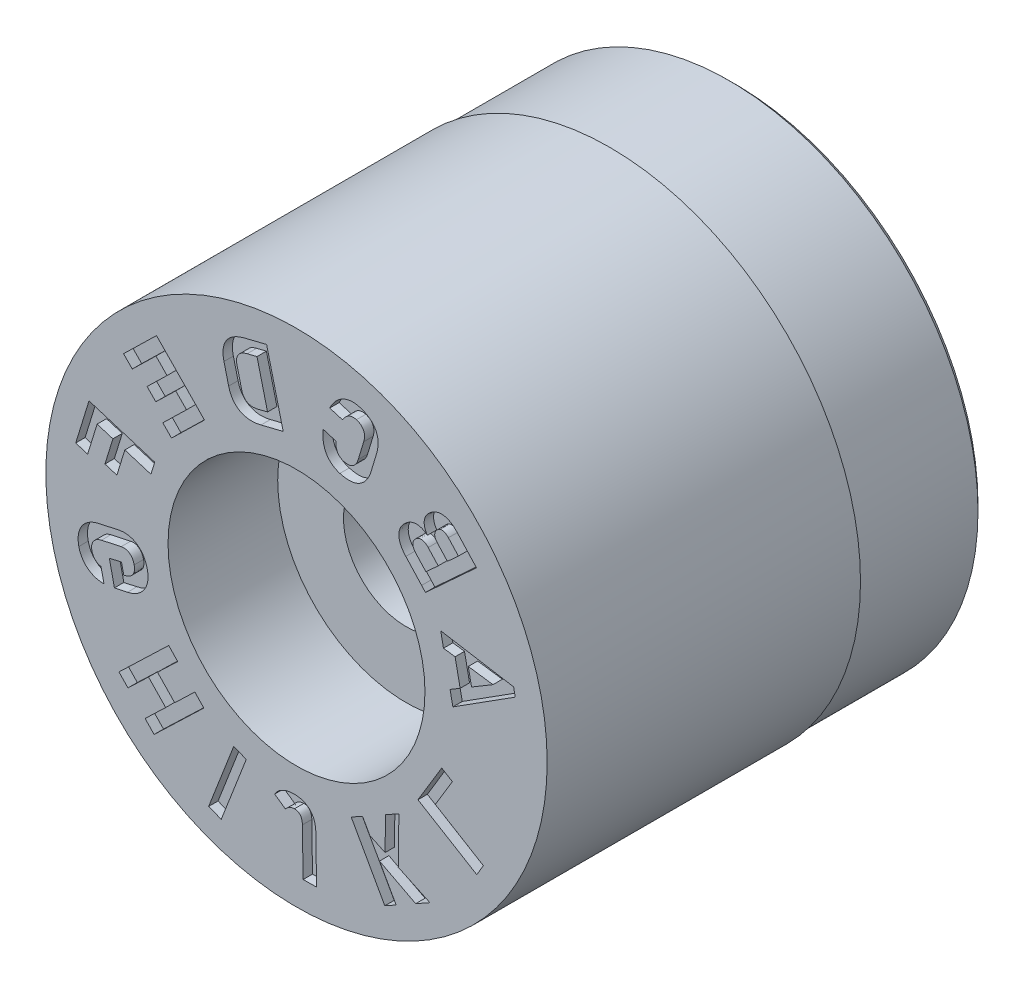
SolidWorks part; units mm, degrees
ref_plane "Front Plane" through (0, 0, 0) normal (0, 0, 1) x (1, 0, 0)
ref_plane "Top Plane" through (0, 0, 0) normal (0, 1, 0) x (1, 0, 0)
ref_plane "Right Plane" through (0, 0, 0) normal (1, 0, 0) x (0, 0, -1)
sketch "Sketch1" plane through (0, 0, 0) normal (1, 0, 0) x (0, 0, -1)
  line L2 (0, 8) -> (0, 4.1)
  line L3 (13.75, 8) -> (0, 8)
  line L4 (-3.7979, 0) -> (49996.2021, 0) construction
  line L8 (14, 2) -> (3.5, 2)
  line L9 (3.5, 4.1) -> (3.5, 2)
  line L10 (3.5, 4.1) -> (0, 4.1)
  line L12 (14, 2) -> (14, 7.75)
  line L16 (14, 7.75) -> (13.75, 8)
  dimension "D1" = 14
  dimension "D2" = 45
  dimension "D3" = 0.25
  dimension "D4" = 16
  dimension "D5" = 8.2
  dimension "D6" = 3.5
  dimension "D7" = 4
revolve "Revolve1" add sketch "Sketch1" angle 360 about L4
sketch "Sketch4" plane through (0, 0, 0) normal (1, 0, 0) x (0, 0, -1)
  line L0 (0, 0) -> (50000, 0) construction
  line L1 (14, -7.75) -> (14, 7.75) construction
  line L2 (10, 8.935) -> (14, 8.935)
  line L3 (10, 8.935) -> (10, 7.935)
  line L4 (10, 7.935) -> (14, 7.935)
  line L5 (14, 8.935) -> (14, 7.935)
  line L6 (13.75, 8) -> (0, 8) construction
  line L9 (0, 8.8) -> (0, -8.8) construction
  dimension "D1" = 1
  dimension "D2" = 0.065
  dimension "D3" = 10
revolve "Cut-Revolve1" cut sketch "Sketch4" angle 360 about L0
sketch "Sketch6" plane through (0, 0, 0) normal (0, 0, 1) x (1, 0, 0)
  line L0 (6.9817, 1.2949) -> (6.929, 1.5531)
  line L1 (6.929, 1.5531) -> (4.6018, 1.9394)
  line L2 (4.6018, 1.9394) -> (4.6909, 1.5014)
  line L3 (4.6909, 1.5014) -> (5.0619, 1.4505)
  line L4 (6.2709, 1.2848) -> (5.5869, 0.8767)
  line L5 (4.9014, 0.4676) -> (4.9905, 0.0295)
  line L6 (4.9905, 0.0295) -> (6.9817, 1.2949)
  line L7 (5.5869, 0.8767) -> (5.4817, 1.393)
  line L8 (4.522, 3.6936) -> (4.1302, 3.3334)
  line L9 (5.0619, 1.4505) -> (5.2231, 0.6595)
  line L10 (5.2231, 0.6595) -> (4.9014, 0.4676)
  line L11 (4.1302, 3.3334) -> (3.8113, 3.6802)
  line L12 (3.8023, 4.0792) -> (3.8053, 4.0821)
  line L13 (4.2031, 4.0404) -> (4.522, 3.6936)
  line L14 (4.0893, -2.7406) -> (3.8759, -3.0942)
  line L15 (4.8172, 3.9651) -> (4.4982, 4.3121)
  line L16 (4.8474, 4.6331) -> (5.1664, 4.2862)
  line L18 (5.744, 4.2516) -> (5.1335, 4.9155)
  line L19 (3.4759, 4.3493) -> (3.472, 4.346)
  line L20 (3.4891, 3.4379) -> (3.9933, 2.8893)
  line L21 (3.9933, 2.8893) -> (4.1168, 2.7554)
  line L23 (5.1664, 4.2862) -> (4.8172, 3.9651)
  line L25 (4.1168, 2.7554) -> (5.744, 4.2516)
  line L26 (2.3808, 5.2332) -> (2.5547, 5.8097)
  line L27 (1.0611, 6.3256) -> (1.4711, 6.2019)
  line L28 (2.1443, 5.9337) -> (1.9703, 5.3572)
  line L29 (1.2615, 5.509) -> (0.8515, 5.6328)
  line L30 (-0.9245, 5.2236) -> (-1.238, 5.1461)
  line L31 (-1.7451, 5.4095) -> (-1.9006, 6.0396)
  line L32 (-1.5746, 6.5087) -> (-1.2613, 6.5862)
  line L33 (-0.8286, 4.8355) -> (-0.8285, 4.8352)
  line L34 (-0.9542, 7.0741) -> (-1.6616, 6.8991)
  line L35 (-2.3151, 5.9241) -> (-2.1654, 5.3184)
  line L36 (-1.1318, 4.7606) -> (-0.4255, 4.935)
  line L37 (-3.8544, 4.3421) -> (-3.5111, 3.9901)
  line L38 (-5.4786, 1.8971) -> (-4.6459, 1.6405)
  line L39 (-1.2613, 6.5862) -> (-0.9245, 5.2236)
  line L40 (-4.4349, -3.7249) -> (-3.7914, -3.1071)
  line L41 (-0.4255, 4.935) -> (-0.9542, 7.0741)
  line L42 (-4.1757, -4.5714) -> (-4.8322, -5.2017)
  line L43 (-4.4856, 4.9892) -> (-4.132, 4.6267)
  line L44 (2.3399, -4.8503) -> (2.1077, -4.4351)
  line L45 (-2.9378, 3.9936) -> (-4.4682, 5.5626)
  line L46 (-3.5111, 3.9901) -> (-4.2666, 3.2533)
  line L47 (-4.2666, 3.2533) -> (-3.9889, 2.9684)
  line L48 (-3.9889, 2.9684) -> (-2.9378, 3.9936)
  line L49 (2.828, -5.0785) -> (2.3399, -4.8503)
  line L50 (-4.132, 4.6267) -> (-4.7686, 4.0057)
  line L51 (-4.7686, 4.0057) -> (-4.4909, 3.7212)
  line L52 (-4.4909, 3.7212) -> (-3.8544, 4.3421)
  line L53 (4.0893, -2.7406) -> (4.0891, -2.7406)
  line L54 (-4.4682, 5.5626) -> (-5.5192, 4.5374)
  line L55 (-5.5192, 4.5374) -> (-5.2411, 4.2524)
  line L56 (-5.2411, 4.2524) -> (-4.4856, 4.9892)
  line L57 (5.4817, 1.393) -> (6.2709, 1.2848)
  line L59 (-6.363, 2.1696) -> (-5.8596, 2.0145)
  line L60 (-4.6459, 1.6405) -> (-4.5243, 2.036)
  line L61 (-4.5243, 2.036) -> (-6.6222, 2.6825)
  line L62 (-5.8596, 2.0145) -> (-6.1135, 1.1906)
  line L63 (-6.1135, 1.1906) -> (-5.7323, 1.0733)
  line L64 (-5.7323, 1.0733) -> (-5.4786, 1.8971)
  line L66 (-6.6222, 2.6825) -> (-7.0468, 1.3044)
  line L67 (-7.0468, 1.3044) -> (-6.6656, 1.1872)
  line L68 (-6.6656, 1.1872) -> (-6.363, 2.1696)
  line L70 (-5.8115, -2.0829) -> (-5.3934, -1.9925)
  line L71 (-5.6862, -0.4165) -> (-6.317, -0.5537)
  line L72 (-6.1449, -2.1365) -> (-6.2396, -1.7012)
  line L73 (-6.2264, -0.9712) -> (-5.5956, -0.834)
  line L74 (-5.4785, -1.573) -> (-5.5135, -1.5806)
  line L75 (-5.5135, -1.5806) -> (-5.5839, -1.2569)
  line L76 (-5.5839, -1.2569) -> (-5.9727, -1.3413)
  line L77 (-5.9727, -1.3413) -> (-5.8115, -2.0829)
  line L78 (-4.8322, -5.2017) -> (-4.5449, -5.5008)
  line L79 (-4.5449, -5.5008) -> (-2.9569, -3.9763)
  line L80 (-2.9569, -3.9763) -> (-3.2443, -3.6772)
  line L81 (-3.2443, -3.6772) -> (-3.8877, -4.2949)
  line L82 (-5.6667, -4.3325) -> (-5.3794, -4.6316)
  line L83 (-5.3794, -4.6316) -> (-4.7229, -4.0014)
  line L84 (-3.7914, -3.1071) -> (-4.0788, -2.808)
  line L85 (-4.0788, -2.808) -> (-5.6667, -4.3325)
  line L86 (-4.7229, -4.0014) -> (-4.1757, -4.5714)
  line L88 (-3.8877, -4.2949) -> (-4.4349, -3.7249)
  line L90 (-1.603, -4.7178) -> (-2.0048, -4.562)
  line L91 (-2.0048, -4.562) -> (-2.8038, -6.6189)
  line L92 (-2.8038, -6.6189) -> (-2.402, -6.7747)
  line L93 (-2.402, -6.7747) -> (-1.603, -4.7178)
  line L94 (-0.6972, -5.2231) -> (-0.3544, -5.465)
  line L95 (0.1882, -5.633) -> (0.2101, -7.1323)
  line L96 (0.2101, -7.1323) -> (0.6396, -7.1259)
  line L97 (0.6396, -7.1259) -> (0.6176, -5.6249)
  line L98 (2.6487, -5.4024) -> (3.804, -6.0022)
  line L99 (3.804, -6.0022) -> (4.259, -5.7478)
  line L100 (4.259, -5.7478) -> (3.2472, -5.2746)
  line L102 (2.8182, -6.5535) -> (3.1795, -6.3516)
  line L103 (3.1795, -6.3516) -> (2.6487, -5.4024)
  line L104 (2.1077, -4.4351) -> (1.7464, -4.6371)
  line L105 (1.7464, -4.6371) -> (2.8182, -6.5535)
  line L107 (3.2472, -5.2746) -> (3.2674, -3.7862)
  line L108 (3.2674, -3.7862) -> (2.8388, -4.0259)
  line L109 (2.8388, -4.0259) -> (2.828, -5.0785)
  line L110 (5.7523, -4.2251) -> (5.9649, -3.8724)
  line L111 (5.9649, -3.8724) -> (4.43, -2.9462)
  line L113 (3.8759, -3.0942) -> (5.7523, -4.2251)
  line L114 (4.43, -2.9462) -> (4.9748, -2.0432)
  line L115 (4.9748, -2.0432) -> (4.634, -1.8378)
  line L116 (4.634, -1.8378) -> (4.0893, -2.7406)
  spline S0 degree 3 poles (3.8113, 3.6802) (3.7827, 3.7118) (3.7454, 3.7619) (3.7179, 3.8365) (3.7103, 3.8896) (3.7151, 3.9417) (3.7392, 4.0101) (3.7743, 4.0541) (3.8023, 4.0792) knots 0 0 0 0 0.28358 0.40678 0.523554 0.636467 0.749848 1 1 1 1
  spline S1 degree 3 poles (3.8053, 4.0821) (3.8245, 4.0997) (3.855, 4.1232) (3.9002, 4.1443) (3.9339, 4.1541) (3.9679, 4.1593) (4.0023, 4.1577) (4.0369, 4.1519) (4.0711, 4.1394) (4.1055, 4.1226) (4.1518, 4.0915) (4.1833, 4.0622) (4.2031, 4.0404) knots 0 0 0 0 0.172169 0.251661 0.327831 0.402694 0.477732 0.553965 0.63336 0.717035 0.805718 1 1 1 1
  spline S2 degree 3 poles (4.4982, 4.3121) (4.4725, 4.3407) (4.4381, 4.3861) (4.415, 4.4546) (4.4091, 4.5034) (4.4152, 4.5513) (4.4389, 4.6151) (4.4724, 4.6561) (4.4987, 4.6801) knots 0 0 0 0 0.278439 0.400073 0.51501 0.62887 0.743441 1 1 1 1
  spline S3 degree 3 poles (4.4987, 4.6801) (4.5222, 4.702) (4.5626, 4.7287) (4.6236, 4.7428) (4.6694, 4.7419) (4.7155, 4.7304) (4.7797, 4.6993) (4.8212, 4.6612) (4.8474, 4.6331) knots 0 0 0 0 0.243029 0.353983 0.466706 0.583917 0.708816 1 1 1 1
  spline S4 degree 3 poles (5.1335, 4.9155) (5.0884, 4.9642) (5.0178, 5.0312) (4.9125, 5.0994) (4.8355, 5.1382) (4.7578, 5.1645) (4.68, 5.1785) (4.6024, 5.181) (4.5253, 5.17) (4.4493, 5.1475) (4.3475, 5.0996) (4.2779, 5.0479) (4.2347, 5.0078) knots 0 0 0 0 0.194494 0.282692 0.366303 0.445926 0.521873 0.596751 0.672045 0.748593 0.8277 1 1 1 1
  spline S5 degree 3 poles (4.2347, 5.0078) (4.2047, 4.9802) (4.1646, 4.9351) (4.1227, 4.8681) (4.0998, 4.8162) (4.0839, 4.7628) (4.0749, 4.708) (4.0742, 4.6521) (4.0794, 4.595) (4.0929, 4.5373) (4.1207, 4.4581) (4.1513, 4.4012) (4.1756, 4.3649) knots 0 0 0 0 0.172073 0.253315 0.332707 0.410642 0.487805 0.566183 0.646352 0.729137 0.815534 1 1 1 1
  spline S6 degree 3 poles (4.1756, 4.3649) (4.1402, 4.3951) (4.0832, 4.4332) (4.0022, 4.471) (3.9417, 4.4895) (3.8812, 4.5011) (3.8206, 4.5032) (3.7601, 4.4982) (3.7003, 4.4841) (3.6415, 4.4624) (3.563, 4.422) (3.5098, 4.3801) (3.4759, 4.3493) knots 0 0 0 0 0.179926 0.264185 0.345402 0.424519 0.502196 0.579789 0.658904 0.739474 0.822221 1 1 1 1
  spline S7 degree 3 poles (3.472, 4.346) (3.4278, 4.3065) (3.3711, 4.2405) (3.3137, 4.1429) (3.2852, 4.0682) (3.2687, 3.9917) (3.2636, 3.9136) (3.2718, 3.8344) (3.2913, 3.7543) (3.323, 3.674) (3.3837, 3.5637) (3.4439, 3.487) (3.4891, 3.4379) knots 0 0 0 0 0.172248 0.25144 0.328386 0.403802 0.478629 0.555147 0.634504 0.717947 0.805522 1 1 1 1
  spline S8 degree 3 poles (1.3845, 4.6804) (1.4231, 4.6688) (1.4809, 4.6541) (1.5579, 4.6412) (1.6135, 4.6358) (1.6675, 4.6333) (1.7205, 4.6342) (1.7718, 4.6396) (1.8221, 4.6474) (1.8708, 4.6591) (1.9179, 4.6743) (1.9631, 4.693) (2.0067, 4.7151) (2.0483, 4.7406) (2.0886, 4.7691) (2.1272, 4.801) (2.1639, 4.8365) (2.1982, 4.8755) (2.231, 4.9171) (2.2614, 4.962) (2.2897, 5.0101) (2.3157, 5.0614) (2.3481, 5.1353) (2.3688, 5.1933) (2.3808, 5.2332) knots 0 0 0 0 0.093409 0.137863 0.180596 0.222679 0.263196 0.303035 0.342218 0.380913 0.418858 0.456774 0.494122 0.531903 0.569698 0.60835 0.647655 0.687839 0.728452 0.770331 0.813316 0.857575 0.903607 1 1 1 1
  spline S9 degree 3 poles (2.5547, 5.8097) (2.5669, 5.8496) (2.5824, 5.909) (2.5957, 5.9885) (2.602, 6.0456) (2.6053, 6.1014) (2.6049, 6.1557) (2.6007, 6.2086) (2.5936, 6.2601) (2.5826, 6.3097) (2.5686, 6.3578) (2.551, 6.4039) (2.5301, 6.4483) (2.506, 6.4908) (2.4788, 6.5315) (2.4483, 6.5705) (2.414, 6.6071) (2.377, 6.6422) (2.3367, 6.6749) (2.2935, 6.7054) (2.2471, 6.7335) (2.1978, 6.7595) (2.1264, 6.7914) (2.0703, 6.8114) (2.0316, 6.8228) knots 0 0 0 0 0.096527 0.142046 0.186449 0.229401 0.271233 0.31213 0.352061 0.391448 0.429759 0.46796 0.505512 0.543104 0.580942 0.618791 0.657554 0.69685 0.736812 0.777643 0.819189 0.862318 0.906505 1 1 1 1
  spline S10 degree 3 poles (2.0316, 6.8228) (1.9687, 6.8417) (1.8726, 6.8607) (1.7444, 6.8593) (1.6522, 6.8465) (1.5627, 6.8221) (1.4769, 6.7847) (1.3952, 6.7358) (1.3176, 6.6752) (1.2448, 6.6038) (1.152, 6.4911) (1.0952, 6.394) (1.0611, 6.3256) knots 0 0 0 0 0.164532 0.242888 0.320012 0.397205 0.474318 0.553482 0.635125 0.720033 0.808421 1 1 1 1
  spline S11 degree 3 poles (1.4711, 6.2019) (1.4882, 6.2324) (1.5161, 6.2755) (1.5607, 6.3254) (1.5949, 6.3576) (1.6309, 6.3849) (1.6683, 6.4072) (1.7072, 6.4236) (1.7469, 6.4356) (1.7876, 6.4422) (1.8433, 6.4429) (1.885, 6.436) (1.912, 6.4272) knots 0 0 0 0 0.194907 0.284821 0.372021 0.455712 0.536106 0.61366 0.690482 0.766447 0.842395 1 1 1 1
  spline S12 degree 3 poles (1.912, 6.4272) (1.9465, 6.4167) (1.9959, 6.3969) (2.053, 6.3585) (2.0881, 6.3255) (2.1181, 6.2892) (2.1406, 6.2481) (2.1578, 6.2036) (2.1682, 6.1552) (2.1722, 6.1037) (2.1683, 6.0287) (2.1556, 5.9719) (2.1443, 5.9337) knots 0 0 0 0 0.174749 0.255028 0.331954 0.40698 0.481695 0.557948 0.637228 0.720133 0.807077 1 1 1 1
  spline S13 degree 3 poles (1.9703, 5.3572) (1.9586, 5.3193) (1.938, 5.2648) (1.899, 5.2007) (1.8672, 5.1601) (1.8321, 5.1256) (1.793, 5.0987) (1.7517, 5.0767) (1.7067, 5.063) (1.6594, 5.0554) (1.5906, 5.0549) (1.5387, 5.0662) (1.504, 5.076) knots 0 0 0 0 0.192671 0.280441 0.36332 0.441932 0.518111 0.592729 0.667999 0.744932 0.824738 1 1 1 1
  spline S14 degree 3 poles (1.504, 5.076) (1.4766, 5.0849) (1.4365, 5.1007) (1.3899, 5.1328) (1.359, 5.1604) (1.3319, 5.1921) (1.3088, 5.2274) (1.2906, 5.2667) (1.2755, 5.309) (1.2653, 5.3548) (1.2569, 5.4217) (1.2582, 5.4737) (1.2615, 5.509) knots 0 0 0 0 0.159963 0.23603 0.31203 0.38846 0.465863 0.54484 0.627517 0.714071 0.803748 1 1 1 1
  spline S15 degree 3 poles (0.8515, 5.6328) (0.8428, 5.5566) (0.8371, 5.444) (0.8521, 5.2984) (0.873, 5.1985) (0.9042, 5.1054) (0.9447, 5.0193) (0.9961, 4.9413) (1.0561, 4.8707) (1.1254, 4.8086) (1.2318, 4.7373) (1.3217, 4.6994) (1.3845, 4.6804) knots 0 0 0 0 0.192196 0.280692 0.365902 0.447264 0.526138 0.603429 0.680429 0.757536 0.835747 1 1 1 1
  spline S16 degree 3 poles (-1.238, 5.1461) (-1.2694, 5.1383) (-1.3158, 5.1297) (-1.3771, 5.1249) (-1.4196, 5.1261) (-1.4602, 5.1298) (-1.4985, 5.1385) (-1.5352, 5.1492) (-1.5692, 5.1652) (-1.6011, 5.1838) (-1.6303, 5.2062) (-1.6565, 5.2322) (-1.6806, 5.2609) (-1.701, 5.2934) (-1.725, 5.3422) (-1.7388, 5.3817) (-1.7451, 5.4095) knots 0 0 0 0 0.149228 0.217861 0.283381 0.345618 0.405909 0.464496 0.522086 0.578808 0.635036 0.69159 0.748735 0.807622 0.868398 1 1 1 1
  spline S17 degree 3 poles (-1.9006, 6.0396) (-1.9074, 6.0671) (-1.9149, 6.1083) (-1.9157, 6.1627) (-1.9127, 6.201) (-1.9052, 6.2376) (-1.8943, 6.2727) (-1.8784, 6.3058) (-1.8591, 6.3374) (-1.8357, 6.3668) (-1.8094, 6.3948) (-1.7783, 6.4191) (-1.7448, 6.4423) (-1.7071, 6.4621) (-1.6515, 6.4879) (-1.6056, 6.5002) (-1.5746, 6.5087) knots 0 0 0 0 0.131132 0.192274 0.251269 0.308207 0.364357 0.420562 0.477522 0.53501 0.593964 0.654495 0.71702 0.781929 0.851101 1 1 1 1
  spline S18 degree 3 poles (-1.6616, 6.8991) (-1.7047, 6.8883) (-1.7676, 6.8704) (-1.848, 6.8406) (-1.9038, 6.8161) (-1.9568, 6.79) (-2.0064, 6.7614) (-2.0528, 6.7303) (-2.0962, 6.6973) (-2.1367, 6.6626) (-2.1731, 6.6253) (-2.2066, 6.5866) (-2.2362, 6.5457) (-2.2621, 6.5029) (-2.2849, 6.4585) (-2.3043, 6.4121) (-2.3198, 6.3638) (-2.332, 6.3139) (-2.3405, 6.2624) (-2.3457, 6.2095) (-2.3469, 6.1551) (-2.3444, 6.0993) (-2.3366, 6.0217) (-2.3248, 5.9632) (-2.3151, 5.9241) knots 0 0 0 0 0.09973 0.146796 0.192589 0.236591 0.279607 0.321141 0.361993 0.401988 0.440751 0.479038 0.516883 0.554086 0.591445 0.628895 0.66689 0.70543 0.74425 0.784019 0.824757 0.866366 0.909455 1 1 1 1
  spline S19 degree 3 poles (-2.1654, 5.3184) (-2.1558, 5.2811) (-2.1399, 5.2262) (-2.1121, 5.1566) (-2.089, 5.1076) (-2.0631, 5.0616) (-2.0351, 5.0177) (-2.0043, 4.9768) (-1.9714, 4.9381) (-1.936, 4.9025) (-1.8979, 4.8701) (-1.8576, 4.8406) (-1.8148, 4.8144) (-1.7695, 4.7914) (-1.722, 4.7714) (-1.6721, 4.7542) (-1.62, 4.7404) (-1.5656, 4.7299) (-1.5092, 4.723) (-1.4509, 4.7205) (-1.3907, 4.7211) (-1.3287, 4.7255) (-1.2416, 4.7361) (-1.1759, 4.7493) (-1.1318, 4.7606) knots 0 0 0 0 0.08669 0.128285 0.168675 0.208371 0.247191 0.285672 0.323608 0.361264 0.398546 0.435996 0.473542 0.511424 0.550135 0.589389 0.630087 0.671473 0.714012 0.75773 0.802701 0.849378 0.897596 1 1 1 1
  spline S20 degree 3 poles (-5.3934, -1.9925) (-5.3549, -1.9839) (-5.2981, -1.969) (-5.2256, -1.9427) (-5.1744, -1.9202) (-5.1255, -1.8957) (-5.0793, -1.8679) (-5.0352, -1.8382) (-4.9939, -1.8053) (-4.9552, -1.7706) (-4.9197, -1.7335) (-4.8871, -1.6946) (-4.858, -1.6536) (-4.8316, -1.6109) (-4.8091, -1.5659) (-4.7887, -1.5192) (-4.7721, -1.4706) (-4.7584, -1.4207) (-4.7487, -1.3695) (-4.742, -1.3172) (-4.7386, -1.2638) (-4.7394, -1.2093) (-4.7451, -1.1344) (-4.7534, -1.078) (-4.7621, -1.0404) knots 0 0 0 0 0.092156 0.136526 0.17972 0.222247 0.26394 0.305281 0.346167 0.386703 0.426415 0.465827 0.504837 0.543477 0.582641 0.622094 0.662004 0.702317 0.742521 0.783501 0.824948 0.867208 0.910296 1 1 1 1
  spline S21 degree 3 poles (-4.7621, -1.0404) (-4.77, -1.0024) (-4.7853, -0.9469) (-4.8111, -0.8758) (-4.8325, -0.8253) (-4.8569, -0.7775) (-4.8837, -0.7318) (-4.9127, -0.6883) (-4.9447, -0.6477) (-4.9787, -0.6097) (-5.0145, -0.5745) (-5.0523, -0.5425) (-5.0918, -0.5134) (-5.1334, -0.4874) (-5.1768, -0.4645) (-5.222, -0.4444) (-5.2691, -0.428) (-5.3176, -0.4148) (-5.3672, -0.4041) (-5.4179, -0.398) (-5.4696, -0.3948) (-5.5224, -0.3944) (-5.595, -0.4004) (-5.6498, -0.4078) (-5.6862, -0.4165) knots 0 0 0 0 0.092648 0.137413 0.180621 0.223496 0.265481 0.307091 0.348218 0.388978 0.428755 0.468199 0.507033 0.545944 0.585143 0.624335 0.663972 0.704011 0.744352 0.785068 0.825952 0.867964 0.910999 1 1 1 1
  spline S22 degree 3 poles (-6.317, -0.5537) (-6.3555, -0.5623) (-6.4123, -0.5771) (-6.4848, -0.6035) (-6.5359, -0.6259) (-6.5845, -0.6506) (-6.631, -0.6776) (-6.675, -0.7075) (-6.7162, -0.7401) (-6.7546, -0.775) (-6.7901, -0.8118) (-6.8223, -0.8508) (-6.8514, -0.8918) (-6.878, -0.9344) (-6.901, -0.979) (-6.9208, -1.0257) (-6.9374, -1.0742) (-6.9513, -1.1242) (-6.9605, -1.1757) (-6.9676, -1.2279) (-6.9701, -1.2814) (-6.9701, -1.3358) (-6.9641, -1.4108) (-6.9561, -1.4673) (-6.9473, -1.5048) knots 0 0 0 0 0.092244 0.136656 0.179891 0.22211 0.263807 0.305187 0.346111 0.386354 0.426103 0.465239 0.504286 0.543253 0.582238 0.621471 0.661418 0.70177 0.742297 0.783316 0.824639 0.867081 0.91021 1 1 1 1
  spline S23 degree 3 poles (-6.9473, -1.5048) (-6.934, -1.5666) (-6.9049, -1.6567) (-6.8459, -1.7666) (-6.7938, -1.8421) (-6.7335, -1.9104) (-6.666, -1.9705) (-6.5917, -2.0222) (-6.5111, -2.0647) (-6.4252, -2.098) (-6.3038, -2.1302) (-6.2086, -2.1372) (-6.1449, -2.1365) knots 0 0 0 0 0.17073 0.253607 0.335993 0.417805 0.498918 0.579599 0.661589 0.744332 0.827763 1 1 1 1
  spline S24 degree 3 poles (-6.2396, -1.7012) (-6.2634, -1.6996) (-6.298, -1.6906) (-6.3418, -1.6724) (-6.3725, -1.6542) (-6.4015, -1.633) (-6.4281, -1.6084) (-6.4519, -1.5807) (-6.4952, -1.5207) (-6.519, -1.4623) (-6.5294, -1.4141) knots 0 0 0 0 0.163404 0.244249 0.326188 0.408642 0.491198 0.574875 0.659834 1 1 1 1
  spline S25 degree 3 poles (-6.5294, -1.4141) (-6.5362, -1.3802) (-6.5428, -1.3291) (-6.5356, -1.2622) (-6.5249, -1.2151) (-6.5067, -1.1707) (-6.483, -1.1296) (-6.4532, -1.092) (-6.4174, -1.0586) (-6.3766, -1.0291) (-6.3142, -0.9952) (-6.2621, -0.9795) (-6.2264, -0.9712) knots 0 0 0 0 0.172071 0.252891 0.332752 0.411492 0.489737 0.568063 0.648792 0.732039 0.817587 1 1 1 1
  spline S26 degree 3 poles (-5.5956, -0.834) (-5.564, -0.8266) (-5.5161, -0.8228) (-5.4533, -0.829) (-5.4091, -0.8405) (-5.3673, -0.8582) (-5.3283, -0.8812) (-5.2936, -0.9112) (-5.2619, -0.9456) (-5.2345, -0.9855) (-5.2027, -1.0461) (-5.1881, -1.0967) (-5.18, -1.1312) knots 0 0 0 0 0.168953 0.2486 0.327822 0.406131 0.484587 0.563012 0.644083 0.727995 0.814612 1 1 1 1
  spline S27 degree 3 poles (-5.18, -1.1312) (-5.1723, -1.1655) (-5.1671, -1.217) (-5.1716, -1.2845) (-5.1827, -1.3314) (-5.1987, -1.3757) (-5.222, -1.4163) (-5.2511, -1.4532) (-5.2861, -1.4867) (-5.3269, -1.5152) (-5.3892, -1.5497) (-5.4423, -1.5643) (-5.4785, -1.573) knots 0 0 0 0 0.174479 0.255993 0.335534 0.413326 0.489456 0.567252 0.646709 0.729224 0.814173 1 1 1 1
  spline S28 degree 3 poles (-0.0946, -4.9131) (-0.1588, -4.9143) (-0.2537, -4.9237) (-0.3727, -4.9601) (-0.4543, -4.9952) (-0.5287, -5.0395) (-0.6164, -5.1098) (-0.6691, -5.1754) (-0.6972, -5.2231) knots 0 0 0 0 0.272328 0.400217 0.525733 0.647569 0.765919 1 1 1 1
  spline S29 degree 3 poles (-0.3544, -5.465) (-0.3369, -5.4423) (-0.3076, -5.411) (-0.2623, -5.3764) (-0.2256, -5.3554) (-0.1874, -5.338) (-0.1349, -5.3207) (-0.0935, -5.3162) (-0.0662, -5.3155) knots 0 0 0 0 0.255127 0.381406 0.507403 0.631821 0.755558 1 1 1 1
  spline S30 degree 3 poles (-0.0662, -5.3155) (-0.0304, -5.3156) (0.0241, -5.3227) (0.0846, -5.3597) (0.1218, -5.3968) (0.151, -5.4436) (0.1809, -5.5217) (0.1871, -5.5876) (0.1882, -5.633) knots 0 0 0 0 0.23539 0.345421 0.457098 0.575101 0.702417 1 1 1 1
  spline S31 degree 3 poles (0.6176, -5.6249) (0.6172, -5.5883) (0.614, -5.5342) (0.6042, -5.4638) (0.5942, -5.4139) (0.5823, -5.3661) (0.5674, -5.3206) (0.5501, -5.2771) (0.5236, -5.2227) (0.4846, -5.1598) (0.4283, -5.0927) (0.3613, -5.0368) (0.2993, -4.9982) (0.2458, -4.9722) (0.2028, -4.9562) (0.1581, -4.9421) (0.1114, -4.9308) (0.0627, -4.9226) (-0.006, -4.9137) (-0.0589, -4.9132) (-0.0946, -4.9131) knots 0 0 0 0 0.096032 0.141746 0.186236 0.229182 0.27082 0.311708 0.351672 0.429252 0.505033 0.580195 0.656773 0.696008 0.735865 0.776859 0.818662 0.861827 0.906192 1 1 1 1
extrude "Cut-Extrude1" cut sketch "Sketch6" against normal blind 0.3 contours L35 S19 L36 L41 L34 S18 L31 S17 L32 L39 L30 S16 | L55 L56 L43 L50 L51 L52 L37 L46 L47 L48 L45 L54 | L67 L68 L59 L62 L63 L64 L38 L60 L61 L66 | L81 L88 L40 L84 L85 L82 L83 L86 L42 L78 L79 L80 | L92 L93 L90 L91 | L97 S31 S28 L94 S29 S30 L95 L96 | L108 L109 L49 L44 L104 L105 L102 L103 L98 L99 L100 L107 | L115 L116 L14 L113 L110 L111 L114 | L9 L10 L5 L6 L0 L1 L2 L3 L7 L57 L4 | L19 S7 L20 L21 L25 L18 S4 S5 S6 S2 S3 L16 L23 L15 L12 S1 L13 L8 L11 S0 | L29 S15 S8 L26 S9 S10 L27 S11 S12 L28 S13 S14 | L71 S22 S23 L72 S24 S25 L73 S26 S27 L74 L75 L76 L77 L70 S20 S21
